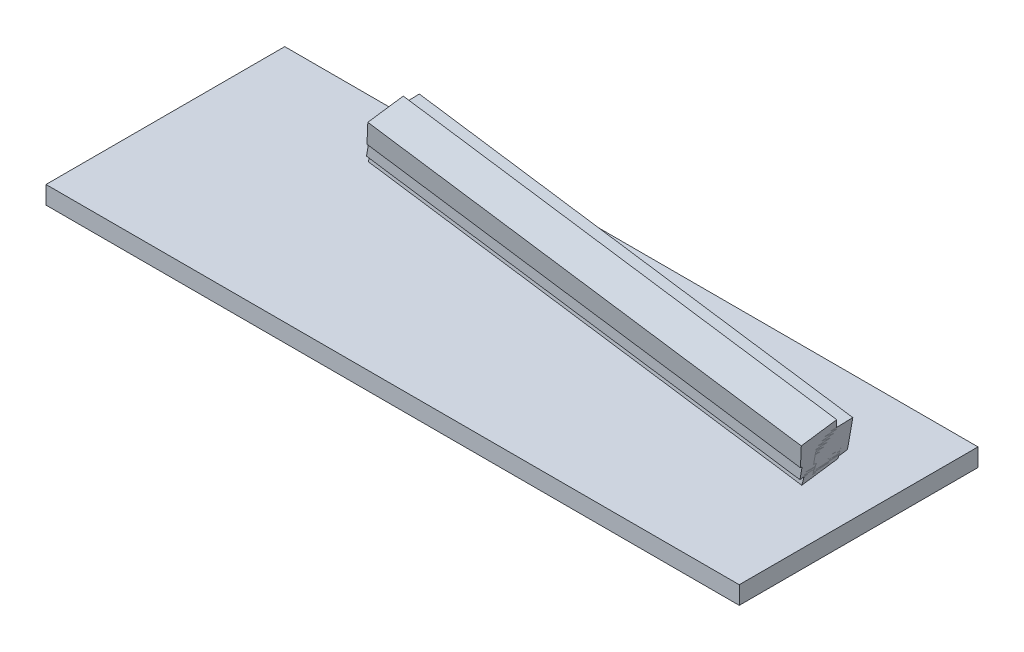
SolidWorks part; units mm, degrees
ref_plane "Front Plane" through (0, 0, 0) normal (0, 0, 1) x (1, 0, 0)
ref_plane "Top Plane" through (0, 0, 0) normal (0, 1, 0) x (1, 0, 0)
ref_plane "Right Plane" through (0, 0, 0) normal (1, 0, 0) x (0, 0, -1)
sketch "Sketch1" plane through (0, 0, 0) normal (1, 0, 0) x (0, 0, -1)
  line L0 (-6.3156, -5) -> (9.8613, -5) construction
  line L1 (-6.3917, 4.9027) -> (3.511, 6.2944) construction
  line L2 (-6.3917, 4.9027) -> (-5, -5) construction
  line L3 (-5, -5) -> (4.9027, -3.6083) construction
  line L4 (3.511, 6.2944) -> (4.9027, -3.6083) construction
  point P0 (0, 0)
  point P8 (4.7834, -2.9297)
  point P9 (4.7016, -2.5755)
  dimension "D1" = 10
  dimension "D2" = 10
  dimension "D3" = 8
ref_plane "Plane1" through (0, -0.7859, 5.5922) normal (0, -0.1392, 0.9903) x (0, -0.9903, -0.1392)
sketch "Sketch2" plane through (0, -0.7859, 5.5922) normal (0, -0.1392, 0.9903) x (0, -0.9903, -0.1392)
  line L0 (-5.7445, 0) -> (4.2555, 0) construction
  line L1 (-5.7445, 0) -> (4.2555, 0) construction
  line L2 (-5.7445, 0) -> (3.7888, -1.681) construction
  dimension "D1" = 10
ref_plane "Plane2" through (-0.9824, 0.1715, 0.0241) normal (-0.9848, 0.172, 0.0242) x (-0.1736, -0.9752, -0.1371)
sketch "Sketch3" plane through (-0.9824, 0.1715, 0.0241) normal (-0.9848, 0.172, 0.0242) x (-0.1736, -0.9752, -0.1371)
  line L1 (-3.6849, 5.2225) -> (6.3151, 5.2225)
  line L2 (-3.6849, 5.2225) -> (-3.6849, -4.7775)
  line L3 (-3.6849, -4.7775) -> (6.3151, -4.7775)
  line L4 (6.3151, 5.2225) -> (6.3151, -4.7775)
  dimension "D1" = 10
  dimension "D2" = 10
extrude "One Cut 8 Degree Positive" add sketch "Sketch3" along normal blind 120
sketch "Sketch4" plane through (-0.9824, 0.1715, 0.0241) normal (-0.9848, 0.172, 0.0242) x (-0.1736, -0.9752, -0.1371)
  line L0 (8.3903, 5.9959) -> (8.3903, -4.4746) construction
  line L1 (-1.2186, 1.8828) -> (8.3903, 4.6382)
  line L2 (-1.2186, 1.8828) -> (1.5377, -7.7298)
  line L3 (1.5377, -7.7298) -> (11.0709, -4.71)
  line L4 (8.3903, 4.6382) -> (11.0709, -4.71)
  point P6 (3.6761, -2.3489)
  point P7 (-0.638, -2.531)
  point P8 (3.1372, 2.4558)
  dimension "D1" = 10
  dimension "D2" = 10
  dimension "D3" = 16
extrude "One Cut 8 Degree Negative" add sketch "Sketch4" along normal blind 120 separate body
sketch "Sketch5" plane through (-0.9824, 0.1715, 0.0241) normal (0.9848, -0.172, -0.0242) x (-0.0238, 0.0042, -0.9997)
  line L0 (-3.4441, -8.947) -> (6.6569, -7.549)
  line L1 (7.8676, -0.4635) -> (6.1834, -10.3206) construction
  line L2 (6.1834, -10.3206) -> (-3.4441, -8.947) construction
  line L3 (7.8676, -0.4635) -> (6.1834, -10.3206)
  line L4 (6.1834, -10.3206) -> (-3.4441, -8.947)
  dimension "D1" = 16
extrude "Cut-Extrude1" cut sketch "Sketch5" against normal blind 120 contours L0 M4 M5
sketch "Sketch7" plane through (-0.9824, 0.1715, 0.0241) normal (0.9848, -0.172, -0.0242) x (-0.0238, 0.0042, -0.9997)
  line L0 (-4.3074, -6.9714) -> (-4.3001, -3.4786)
  line L2 (-4.3074, -6.9714) -> (-5.6784, 2.9341) construction
  line L3 (-4.3001, -3.4786) -> (-4.7909, -3.4775)
  line L5 (-4.3074, -6.9714) -> (-5.6784, 2.9341)
  dimension "D1" = 8
extrude "Cut-Extrude2" cut sketch "Sketch7" against normal blind 120 contours L0 L3 M5
ref_plane "Plane3" through (0, -10, 0) normal (0, 1, 0) x (1, 0, 0)
sketch "Sketch9" plane through (0, -10, 0) normal (0, 1, 0) x (1, 0, 0)
  line L1 (-182.0985, -34.908) -> (11.5365, -34.908)
  line L2 (-182.0985, -34.908) -> (-182.0985, 31.7779)
  line L3 (-182.0985, 31.7779) -> (11.5365, 31.7779)
  line L4 (11.5365, -34.908) -> (11.5365, 31.7779)
  line L5 (-182.0985, -34.908) -> (11.5365, 31.7779) construction
  line L6 (-182.0985, 31.7779) -> (11.5365, -34.908) construction
  point P0 (-85.281, -1.565)
extrude "Boss-Extrude3" add sketch "Sketch9" against normal blind 5 separate body
sketch "Sketch8" plane through (-0.9824, 0.1715, 0.0241) normal (-0.9848, 0.172, 0.0242) x (-0.1736, -0.9752, -0.1371)
  line L0 (7.7978, 11.2771) -> (7.7978, -5.9382) construction
  line L5 (7.7978, -5.9382) -> (-3.7547, -5.9382) construction
  line L6 (7.7978, 11.2771) -> (11.2959, -13.6131) construction
  line L7 (11.2959, -13.6131) -> (-0.3311, -15.2472) construction
  line L8 (7.7978, 1.8775) -> (7.7978, -8.2207)
  line L10 (7.7978, -8.2207) -> (-0.7131, -9.4169)
  line L11 (-0.7131, -9.4169) -> (-2.1049, 0.4858)
  line L12 (7.7978, -8.2207) -> (9.1896, -8.0251) construction
  line L13 (9.1896, -8.0251) -> (7.314, 5.3198) construction
  line L14 (-2.1049, 0.4858) -> (4.6754, 1.4387)
  line L15 (7.7978, 1.8775) -> (-2.1049, 0.4858) construction
  line L16 (4.6754, 1.4387) -> (5.0289, 0.6447)
  line L17 (5.0289, 0.6447) -> (7.7978, 1.8775)
  dimension "D1" = 16
  dimension "D2" = 10
  dimension "D3" = 10
extrude "Two Cuts Neutral" add sketch "Sketch8" along normal blind 120 separate body
